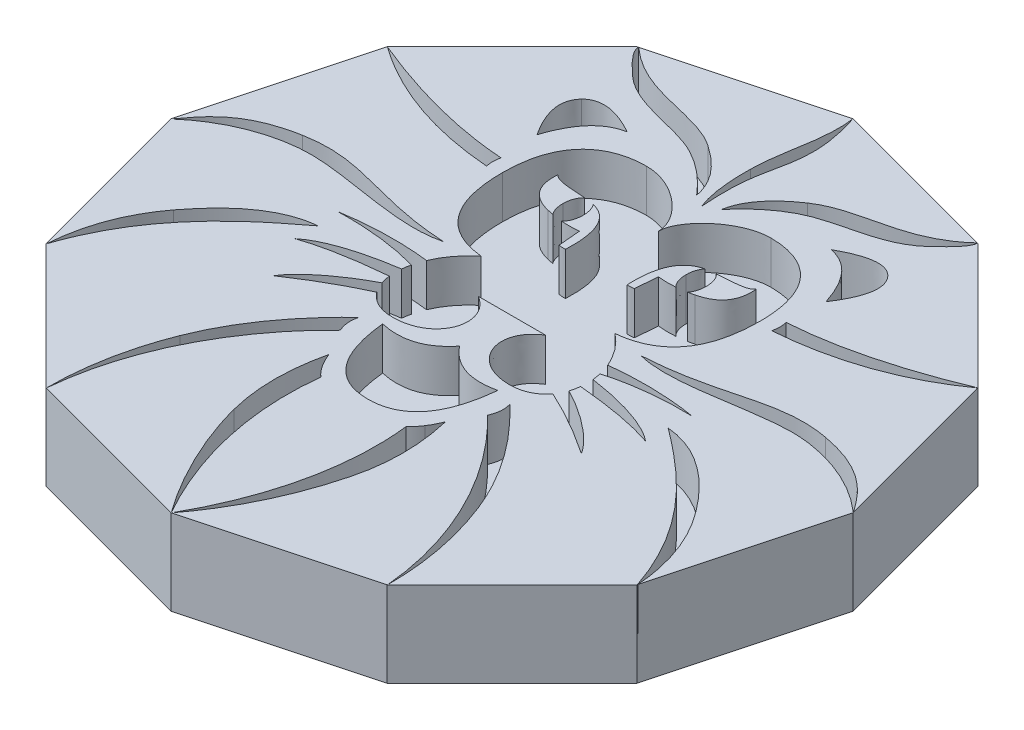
SolidWorks part; units mm, degrees
ref_plane "Front Plane" through (0, 0, 0) normal (0, 0, 1) x (1, 0, 0)
ref_plane "Top Plane" through (0, 0, 0) normal (0, 1, 0) x (1, 0, 0)
ref_plane "Right Plane" through (0, 0, 0) normal (1, 0, 0) x (0, 0, -1)
sketch "Sketch1" plane through (0, 0, 0) normal (0, 1, 0) x (1, 0, 0)
  line L0 (-21.997, -12.7) -> (-12.7, -21.997)
  line L1 (21.997, 12.7) -> (12.7, 21.997)
  line L2 (12.7, 21.997) -> (0, 25.4)
  line L3 (0, 25.4) -> (-12.7, 21.997)
  line L4 (-12.7, 21.997) -> (-21.997, 12.7)
  line L5 (-21.997, 12.7) -> (-25.4, 0)
  line L6 (-25.4, 0) -> (-21.997, -12.7)
  line L7 (-12.7, -21.997) -> (0, -25.4)
  line L8 (0, -25.4) -> (12.7, -21.997)
  line L9 (12.7, -21.997) -> (21.997, -12.7)
  line L10 (21.997, -12.7) -> (25.4, 0)
  line L11 (25.4, 0) -> (21.997, 12.7)
  circle A0 centre (0, 0) radius 24.5345 construction
  dimension "D1" = 50.8
extrude "Boss-Extrude1" add sketch "Sketch1" along normal blind 6.35
sketch "Sketch2" plane through (0, 6.35, 0) normal (0, 1, 0) x (1, 0, 0)
  line B0 (2.8016, 6.3123) -> (2.9431, 7.9678)
  line B1 (-2.9435, 7.9678) -> (-2.8016, 6.3123)
  line B2 (2.5015, 0) -> (0, 0)
  line B3 (0, 0) -> (-2.5018, 0)
  spline B4 degree 3 poles (3.8292, 9.1242) (3.8292, 9.5708) (3.9595, 9.9646) (4.1579, 10.1996) knots 0 0 0 0 1 1 1 1
  spline B5 degree 3 poles (4.1579, 10.1996) (4.0318, 10.1701) (3.9129, 10.135) (3.8051, 10.0914) knots 1 1 1 1 2 2 2 2
  spline B6 degree 2 poles (3.8051, 10.0914) (2.1446, 9.4186) (2.2917, 6.2859) knots 2 2 2 3 3 3
  spline B7 degree 3 poles (2.2917, 6.2859) (2.4488, 6.2671) (2.5697, 6.2649) (2.8016, 6.3123) knots 3 3 3 3 4 4 4 4
  spline B8 degree 3 poles (2.9431, 7.9678) (3.2532, 7.9292) (3.6911, 7.8987) (4.2595, 7.949) knots 5 5 5 5 6 6 6 6
  spline B9 degree 3 poles (4.2595, 7.949) (4.0053, 8.1587) (3.8292, 8.6055) (3.8292, 9.1242) knots 6 6 6 6 7 7 7 7
  spline B10 degree 3 poles (7.3766, 10.8061) (7.0456, 10.3568) (5.9052, 10.4001) (4.8982, 10.3089) knots 0 0 0 0 1 1 1 1
  spline B11 degree 3 poles (4.8982, 10.3089) (5.1587, 10.1031) (5.3399, 9.6508) (5.3399, 9.1242) knots 1 1 1 1 2 2 2 2
  spline B12 degree 3 poles (5.3399, 9.1242) (5.3399, 8.6811) (5.2114, 8.2905) (5.0157, 8.055) knots 2 2 2 2 3 3 3 3
  spline B13 degree 3 poles (5.0157, 8.055) (5.1666, 8.0834) (5.3234, 8.1168) (5.4867, 8.1571) knots 3 3 3 3 4 4 4 4
  spline B14 degree 2 poles (5.4867, 8.1571) (7.5833, 8.6722) (7.3766, 10.8061) knots 4 4 4 5 5 5
  spline B15 degree 3 poles (-3.8055, 10.0914) (-3.9129, 10.135) (-4.0318, 10.1701) (-4.1579, 10.1996) knots 0 0 0 0 1 1 1 1
  spline B16 degree 3 poles (-4.1579, 10.1996) (-3.9598, 9.9646) (-3.8296, 9.5708) (-3.8296, 9.1242) knots 1 1 1 1 2 2 2 2
  spline B17 degree 3 poles (-3.8296, 9.1242) (-3.8296, 8.6055) (-4.0053, 8.1589) (-4.2595, 7.949) knots 2 2 2 2 3 3 3 3
  spline B18 degree 3 poles (-4.2595, 7.949) (-3.6911, 7.8987) (-3.2536, 7.9292) (-2.9435, 7.9678) knots 3 3 3 3 4 4 4 4
  spline B19 degree 3 poles (-2.8016, 6.3123) (-2.5704, 6.2651) (-2.4491, 6.2671) (-2.2917, 6.2861) knots 5 5 5 5 6 6 6 6
  spline B20 degree 2 poles (-2.2917, 6.2861) (-2.1446, 9.4186) (-3.8055, 10.0914) knots 6 6 6 7 7 7
  spline B21 degree 3 poles (-4.8982, 10.3089) (-5.9056, 10.4001) (-7.0459, 10.357) (-7.377, 10.8061) knots 0 0 0 0 1 1 1 1
  spline B22 degree 2 poles (-7.377, 10.8061) (-7.5837, 8.6722) (-5.487, 8.1571) knots 1 1 1 2 2 2
  spline B23 degree 3 poles (-5.487, 8.1571) (-5.3234, 8.1168) (-5.1666, 8.0834) (-5.0161, 8.055) knots 2 2 2 2 3 3 3 3
  spline B24 degree 3 poles (-5.0161, 8.055) (-5.2117, 8.2906) (-5.3399, 8.6813) (-5.3399, 9.1242) knots 3 3 3 3 4 4 4 4
  spline B25 degree 3 poles (-5.3399, 9.1242) (-5.3399, 9.6508) (-5.159, 10.1033) (-4.8982, 10.3089) knots 4 4 4 4 5 5 5 5
  spline B26 degree 3 poles (17.8487, 2.9223) (14.7709, 2.8937) (10.2488, 1.4717) (7.3822, 2.2286) knots 0 0 0 0 1 1 1 1
  spline B27 degree 3 poles (7.3822, 2.2286) (13.0555, 2.5439) (15.3682, 4.6032) (19.4965, 3.8387) knots 1 1 1 1 2 2 2 2
  spline B28 degree 3 poles (19.4965, 3.8387) (23.0835, 3.1747) (24.2831, 1.5675) (25.421, 0) knots 2 2 2 2 3 3 3 3
  spline B29 degree 2 poles (22.018, 12.7) (17.1549, 9.2084) (10.6378, 8.7039) knots 4 4 4 5 5 5
  spline B30 degree 3 poles (10.6378, 8.7039) (10.7122, 9.0585) (10.7298, 9.3397) (10.6378, 9.776) knots 5 5 5 5 6 6 6 6
  spline B31 degree 2 poles (10.6378, 9.776) (15.7806, 10.1158) (22.018, 12.7) knots 6 6 6 7 7 7
  spline B32 degree 3 poles (-25.379, 0) (-24.2411, 1.5675) (-23.0418, 3.1747) (-19.4546, 3.8387) knots 12 12 12 12 13 13 13 13
  spline B33 degree 3 poles (-19.4546, 3.8387) (-15.3264, 4.6032) (-13.0135, 2.5439) (-7.3401, 2.2286) knots 13 13 13 13 14 14 14 14
  spline B34 degree 3 poles (-7.3401, 2.2286) (-10.2068, 1.4717) (-14.729, 2.8937) (-17.8068, 2.9223) knots 14 14 14 14 15 15 15 15
  spline B35 degree 3 poles (-17.8068, 2.9223) (-19.8882, 2.9416) (-22.8525, 2.2286) (-25.379, 0) knots 15 15 15 15 16 16 16 16
  spline B36 degree 2 poles (-12.6792, -21.9971) (-12.6883, -17.7019) (-11.0794, -13.6233) knots 18 18 18 19 19 19
  spline B37 degree 2 poles (-11.0794, -13.6233) (-9.4323, -9.4471) (-5.5783, -5.7814) knots 19 19 19 20 20 20
  spline B38 degree 2 poles (-5.5783, -5.7814) (-5.8177, -6.4869) (-5.4601, -7.3281) knots 20 20 20 21 21 21
  spline B39 degree 3 poles (-5.4601, -7.3281) (-7.2953, -9.0613) (-11.9624, -14.2331) (-12.6792, -21.9971) knots 21 21 21 21 22 22 22 22
  spline B40 degree 3 poles (0.0207, -25.4) (0.0207, -25.3995) (-3.022, -21.4053) (-4.3195, -16.3639) knots 23 23 23 23 24 24 24 24
  spline B41 degree 2 poles (-4.3195, -16.3639) (-5.1825, -13.0116) (-4.3208, -9.3168) knots 24 24 24 25 25 25
  spline B42 degree 2 poles (-4.3208, -9.3168) (-4.0845, -9.8993) (-3.8055, -10.3225) knots 25 25 25 26 26 26
  spline B43 degree 2 poles (-3.8055, -10.3225) (-3.5261, -10.7459) (-3.1588, -11.0794) knots 26 26 26 27 27 27
  spline B44 degree 3 poles (-3.1588, -11.0794) (-3.595, -14.7164) (-3.1295, -19.8202) (0.0207, -25.4) knots 27 27 27 27 28 28 28 28
  spline B45 degree 3 poles (0.0207, -25.4) (3.1716, -19.8202) (3.637, -14.7164) (3.2008, -11.0794) knots 29 29 29 29 30 30 30 30
  spline B46 degree 2 poles (3.2008, -11.0794) (3.5681, -10.7459) (3.8471, -10.3225) knots 30 30 30 31 31 31
  spline B47 degree 2 poles (3.8471, -10.3225) (4.1265, -9.8993) (4.3629, -9.3168) knots 31 31 31 32 32 32
  spline B48 degree 2 poles (4.3629, -9.3168) (5.2245, -13.0116) (4.3615, -16.3639) knots 32 32 32 33 33 33
  spline B49 degree 2 poles (4.3615, -16.3639) (3.0637, -21.4054) (0.0207, -25.4) knots 33 33 33 34 34 34
  spline B50 degree 3 poles (12.721, -21.9971) (12.0044, -14.2331) (7.3374, -9.0613) (5.5018, -7.3281) knots 35 35 35 35 36 36 36 36
  spline B51 degree 2 poles (5.5018, -7.3281) (5.8598, -6.4869) (5.6203, -5.7814) knots 36 36 36 37 37 37
  spline B52 degree 2 poles (5.6203, -5.7814) (9.474, -9.4471) (11.1215, -13.6233) knots 37 37 37 38 38 38
  spline B53 degree 2 poles (11.1215, -13.6233) (12.7303, -17.7019) (12.721, -21.9971) knots 38 38 38 39 39 39
  spline B54 degree 3 poles (22.018, -12.7) (20.088, -6.9384) (16.1806, -3.7931) (13.0555, -1.4259) knots 40 40 40 40 41 41 41 41
  spline B55 degree 2 poles (13.0555, -1.4259) (16.4014, -1.7083) (19.4762, -5.7814) knots 41 41 41 42 42 42
  spline B56 degree 2 poles (19.4762, -5.7814) (21.7375, -8.7767) (22.018, -12.7) knots 42 42 42 43 43 43
  spline B57 degree 3 poles (25.421, 0) (22.8944, 2.2286) (19.9299, 2.9416) (17.8487, 2.9223) knots 44 44 44 44 45 45 45 45
  spline B58 degree 2 poles (10.7849, 12.593) (9.7758, 15.7467) (7.6106, 16.146) knots 0 0 0 1 1 1
  spline B59 degree 2 poles (7.6106, 16.146) (10.3436, 17.6808) (11.4157, 16.5666) knots 1 1 1 2 2 2
  spline B60 degree 2 poles (11.4157, 16.5666) (12.5922, 15.3436) (10.7849, 12.593) knots 2 2 2 3 3 3
  spline B61 degree 3 poles (3.7211, 18.2695) (6.1595, 19.9302) (9.6146, 19.2572) (12.628, 22.0219) knots 0 0 0 0 1 1 1 1
  spline B62 degree 2 poles (12.628, 22.0219) (12.74, 21.5174) (11.0584, 19.9829) knots 1 1 1 2 2 2
  spline B63 degree 3 poles (11.0584, 19.9829) (9.299, 18.3777) (6.9288, 18.3365) (4.8459, 17.565) knots 2 2 2 2 3 3 3 3
  spline B64 degree 3 poles (4.8459, 17.565) (3.4268, 17.0396) (2.0919, 16.0199) (0.946, 14.6534) knots 3 3 3 3 4 4 4 4
  spline B65 degree 2 poles (0.946, 14.6534) (1.2823, 16.6086) (3.7211, 18.2695) knots 4 4 4 5 5 5
  spline B66 degree 3 poles (-0.5743, 18.3376) (-0.5274, 20.9784) (0.3128, 22.7149) (0, 25.3897) knots 0 0 0 0 1 1 1 1
  spline B67 degree 2 poles (0, 25.3897) (0.5994, 23.6012) (0.6463, 21.9539) knots 1 1 1 2 2 2
  spline B68 degree 3 poles (0.6463, 21.9539) (0.6935, 20.3064) (0.1788, 19.0278) (0, 17.3574) knots 2 2 2 2 3 3 3 3
  spline B69 degree 2 poles (0, 17.3574) (-0.1354, 16.0939) (0, 14.1066) knots 3 3 3 4 4 4
  spline B70 degree 2 poles (0, 14.1066) (-0.6215, 15.6969) (-0.5743, 18.3376) knots 4 4 4 5 5 5
  spline B71 degree 3 poles (-12.5861, 22.0219) (-9.5729, 19.2572) (-6.1181, 19.9302) (-3.6794, 18.2695) knots 0 0 0 0 1 1 1 1
  spline B72 degree 2 poles (-3.6794, 18.2695) (-1.2402, 16.6086) (-0.9043, 14.6534) knots 1 1 1 2 2 2
  spline B73 degree 3 poles (-0.9043, 14.6534) (-2.0498, 16.0199) (-3.3852, 17.0396) (-4.8042, 17.565) knots 2 2 2 2 3 3 3 3
  spline B74 degree 3 poles (-4.8042, 17.565) (-6.8871, 18.3365) (-9.257, 18.3777) (-11.0164, 19.9829) knots 3 3 3 3 4 4 4 4
  spline B75 degree 2 poles (-11.0164, 19.9829) (-12.6983, 21.5174) (-12.5861, 22.0219) knots 4 4 4 5 5 5
  spline B76 degree 2 poles (-7.5685, 16.146) (-9.7338, 15.7467) (-10.7432, 12.5932) knots 0 0 0 1 1 1
  spline B77 degree 2 poles (-10.7432, 12.5932) (-12.5505, 15.3436) (-11.3738, 16.5666) knots 1 1 1 2 2 2
  spline B78 degree 2 poles (-11.3738, 16.5666) (-10.3017, 17.6808) (-7.5685, 16.146) knots 2 2 2 3 3 3
  spline B79 degree 2 poles (-10.5959, 8.7039) (-17.1132, 9.2084) (-21.9761, 12.7) knots 0 0 0 1 1 1
  spline B80 degree 2 poles (-21.9761, 12.7) (-15.7386, 10.1158) (-10.5959, 9.776) knots 1 1 1 2 2 2
  spline B81 degree 3 poles (-10.5959, 9.776) (-10.6879, 9.3397) (-10.6703, 9.0585) (-10.5959, 8.7039) knots 2 2 2 2 3 3 3 3
  spline B82 degree 2 poles (-21.9761, -12.7) (-21.6955, -8.7767) (-19.4345, -5.7814) knots 0 0 0 1 1 1
  spline B83 degree 2 poles (-19.4345, -5.7814) (-16.3597, -1.7083) (-13.0135, -1.4259) knots 1 1 1 2 2 2
  spline B84 degree 3 poles (-13.0135, -1.4259) (-16.1389, -3.7931) (-20.0463, -6.9384) (-21.9761, -12.7) knots 2 2 2 2 3 3 3 3
  spline B85 degree 2 poles (0, -10.743) (-3.7476, -10.743) (-4.2888, -5.3399) knots 0 0 0 1 1 1
  spline B86 degree 2 poles (-4.2888, -5.3399) (-1.6399, -5.9495) (0, -3.9131) knots 1 1 1 2 2 2
  spline B87 degree 2 poles (0, -3.9131) (1.6399, -5.9495) (4.2888, -5.3399) knots 2 2 2 3 3 3
  spline B88 degree 2 poles (4.2888, -5.3399) (3.7476, -10.743) (0, -10.743) knots 3 3 3 4 4 4
  spline B89 degree 3 poles (7.0204, -0.468) (7.0693, -0.6783) (7.1055, -0.888) (7.1258, -1.0945) knots 0 0 0 0 1 1 1 1
  spline B90 degree 3 poles (7.1258, -1.0945) (8.9948, -1.3618) (11.6937, -1.9747) (13.0555, -3.1116) knots 1 1 1 1 2 2 2 2
  spline B91 degree 2 poles (13.0555, -3.1116) (10.8417, -2.3442) (7.1196, -2.0088) knots 2 2 2 3 3 3
  spline B92 degree 3 poles (7.1196, -2.0088) (7.09, -2.2559) (7.0383, -2.4939) (6.9632, -2.7177) knots 3 3 3 3 4 4 4 4
  spline B93 degree 3 poles (6.9632, -2.7177) (8.5197, -3.519) (10.5706, -4.9041) (11.4784, -6.3071) knots 4 4 4 4 5 5 5 5
  spline B94 degree 2 poles (11.4784, -6.3071) (8.8332, -4.5401) (6.5529, -3.5133) knots 5 5 5 6 6 6
  spline B95 degree 3 poles (6.5529, -3.5133) (6.0865, -4.1414) (5.3492, -4.5412) (4.3518, -4.5412) knots 6 6 6 6 7 7 7 7
  spline B96 degree 3 poles (4.3518, -4.5412) (1.242, -4.5412) (0.2208, -1.4087) (2.5015, 0) knots 7 7 7 7 8 8 8 8
  spline B97 degree 3 poles (-2.5018, 0) (-0.2205, -1.4087) (-1.2426, -4.541) (-4.3518, -4.541) knots 10 10 10 10 11 11 11 11
  spline B98 degree 3 poles (-4.3518, -4.541) (-5.3495, -4.541) (-6.0868, -4.1414) (-6.5529, -3.5133) knots 11 11 11 11 12 12 12 12
  spline B99 degree 2 poles (-6.5529, -3.5133) (-8.8336, -4.5401) (-11.4789, -6.3071) knots 12 12 12 13 13 13
  spline B100 degree 3 poles (-11.4789, -6.3071) (-10.5711, -4.9039) (-8.5201, -3.519) (-6.9632, -2.7177) knots 13 13 13 13 14 14 14 14
  spline B101 degree 3 poles (-6.9632, -2.7177) (-7.0387, -2.4939) (-7.09, -2.2559) (-7.1193, -2.0088) knots 14 14 14 14 15 15 15 15
  spline B102 degree 2 poles (-7.1193, -2.0088) (-10.8419, -2.3442) (-13.0557, -3.1116) knots 15 15 15 16 16 16
  spline B103 degree 3 poles (-13.0557, -3.1116) (-11.6942, -1.9747) (-8.9952, -1.3617) (-7.1262, -1.0945) knots 16 16 16 16 17 17 17 17
  spline B104 degree 3 poles (-7.1262, -1.0945) (-7.1059, -0.888) (-7.0697, -0.6783) (-7.0204, -0.4678) knots 17 17 17 17 18 18 18 18
  spline B105 degree 2 poles (-7.0204, -0.4678) (-9.8351, 0.3297) (-13.203, 0.2313) knots 18 18 18 19 19 19
  spline B106 degree 3 poles (-13.203, 0.2313) (-10.4566, 0.6961) (-8.0405, 0.5381) (-6.7445, 0.3833) knots 19 19 19 19 20 20 20 20
  spline B107 degree 3 poles (-6.7445, 0.3833) (-6.3927, 1.2199) (-5.8084, 2.0304) (-4.9826, 2.691) knots 20 20 20 20 21 21 21 21
  spline B108 degree 2 poles (-4.9826, 2.691) (-9.5867, 3.1535) (-9.5867, 8.893) knots 21 21 21 22 22 22
  spline B109 degree 3 poles (-9.5867, 8.893) (-9.5867, 13.7284) (-6.6856, 14.6536) (-4.6254, 14.6534) knots 22 22 22 22 23 23 23 23
  spline B110 degree 3 poles (-4.6254, 14.6534) (-2.3757, 14.6534) (0, 12.4669) (0, 10.9113) knots 23 23 23 23 24 24 24 24
  spline B111 degree 3 poles (0, 10.9113) (0, 12.4669) (2.3754, 14.6532) (4.625, 14.6534) knots 24 24 24 24 25 25 25 25
  spline B112 degree 3 poles (4.625, 14.6534) (6.6852, 14.6536) (9.5863, 13.7284) (9.5863, 8.893) knots 25 25 25 25 26 26 26 26
  spline B113 degree 2 poles (9.5863, 8.893) (9.5863, 3.1535) (4.9823, 2.691) knots 26 26 26 27 27 27
  spline B114 degree 3 poles (4.9823, 2.691) (5.8081, 2.0304) (6.3927, 1.2199) (6.7445, 0.3833) knots 27 27 27 27 28 28 28 28
  spline B115 degree 3 poles (6.7445, 0.3833) (8.0398, 0.5381) (10.4562, 0.6961) (13.2026, 0.2312) knots 28 28 28 28 29 29 29 29
  spline B116 degree 2 poles (13.2026, 0.2312) (9.8351, 0.3297) (7.0204, -0.468) knots 29 29 29 30 30 30
sketch_block_instance "Block1-1"
sketch_block "Block1"
extrude "Cut-Extrude1" cut sketch "Sketch2" against normal blind 3.175 contours B116 B115 B114 B113 B112 B111 B110 B109 B108 B107 B106 B105 B104 B103 B102 B101 B100 B99 B98 B97 B3 B2 B96 B95 B94 B93 B92 B91 B90 B89 B25 B24 B23 B22 B21 B20 B19 B1 B18 B17 B16 B15 B14 B13 B12 B11 B10 | B88 B87 B86 B85 | B49 B48 B47 B46 B45 M139 | B44 B43 B42 B41 B40 M139 | B39 B38 B37 B36 | B53 B52 B51 B50 M140 | B56 B55 B54 M141 | B57 B28 B27 B26 M130 | B84 B83 B82 | B35 B34 B33 B32 | B81 B80 B79 | B78 B77 B76 | B60 B59 B58 | B31 B30 B29 M130 | B70 B69 B68 B67 B66 | B75 B74 B73 B72 B71 | B65 B64 B63 B62 B61 M132
